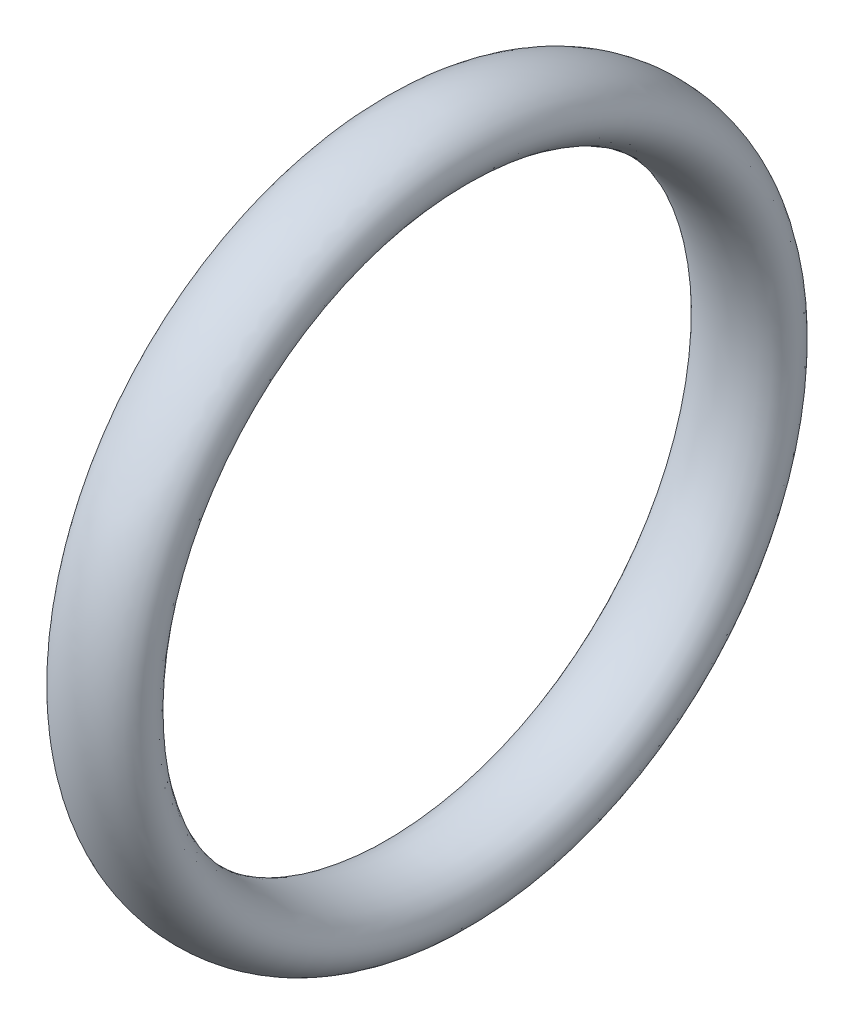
SolidWorks part; units mm, degrees
ref_plane "Face" through (0, 0, 0) normal (0, 0, 1) x (1, 0, 0)
ref_plane "Dessus" through (0, 0, 0) normal (0, 1, 0) x (1, 0, 0)
ref_plane "Droite" through (0, 0, 0) normal (1, 0, 0) x (0, 0, -1)
sketch "Esquisse1" plane through (0, 0, 0) normal (0, 0, 1) x (1, 0, 0)
  line L0 (0, 0) -> (84.4278, 0) construction
  ellipse E0 centre (0, 10) end of major axis (1.5, 10) minor radius 1
  dimension "D1" = 10
  dimension "D2" = 2
  dimension "D3" = 3
revolve "Révolution1" add sketch "Esquisse1" angle 360 about L0
